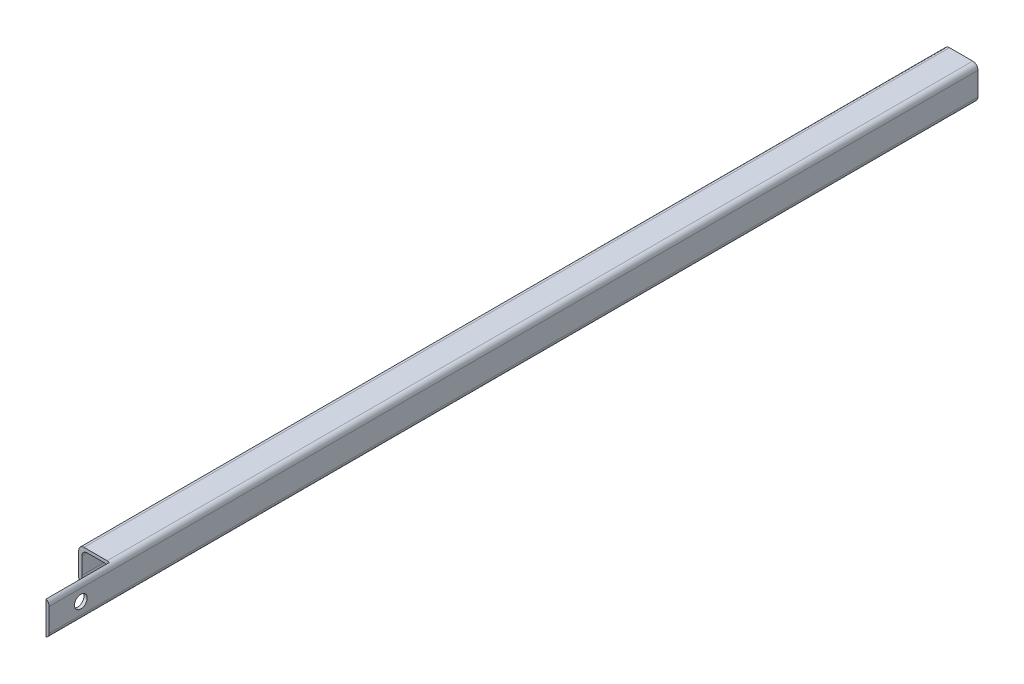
SolidWorks part; units mm, degrees
ref_plane "Plan1" through (0, 0, 0) normal (0, 0, 1) x (1, 0, 0)
ref_plane "Plan2" through (0, 0, 0) normal (0, 1, 0) x (1, 0, 0)
ref_plane "Plan3" through (0, 0, 0) normal (1, 0, 0) x (0, 0, -1)
sketch "Esquisse1" plane through (0, 0, 0) normal (0, 0, 1) x (1, 0, 0)
  line L0 (-5.5, 8) -> (5.5, 8)
  line L1 (-8, 5.5) -> (-8, -5.5)
  line L2 (5.5, -8) -> (-5.5, -8)
  line L3 (8, -5.5) -> (8, 5.5)
  line L4 (-4, 6.5) -> (4, 6.5)
  line L5 (-6.5, 4) -> (-6.5, -4)
  line L6 (4, -6.5) -> (-4, -6.5)
  line L7 (6.5, -4) -> (6.5, 4)
  line L8 (-48.7418, 0) -> (48.7418, 0) construction
  line L9 (0, 57.3432) -> (0, -57.3432) construction
  arc A0 (-4, 6.5) -> (-6.5, 4) centre (-4, 4) ccw
  arc A1 (6.5, 4) -> (4, 6.5) centre (4, 4) ccw
  arc A2 (6.5, -4) -> (4, -6.5) centre (4, -4) cw
  arc A3 (-6.5, -4) -> (-4, -6.5) centre (-4, -4) ccw
  arc A4 (-5.5, 8) -> (-8, 5.5) centre (-5.5, 5.5) ccw
  arc A5 (8, 5.5) -> (5.5, 8) centre (5.5, 5.5) ccw
  arc A6 (8, -5.5) -> (5.5, -8) centre (5.5, -5.5) cw
  arc A7 (-5.5, -8) -> (-8, -5.5) centre (-5.5, -5.5) cw
  dimension "D1" = 2.5
  dimension "D2" = 16
  dimension "D3" = 13
  dimension "D4" = 13
  dimension "D5" = 16
extrude "Base-Extrusion" add sketch "Esquisse1" along normal blind 440
sketch "Esquisse2" plane through (0, 0, 0) normal (0, 1, 0) x (1, 0, 0)
  line L0 (6.5, -440) -> (-8, -440)
  line L1 (6.5, -440) -> (6.5, -410)
  line L2 (-8, -410) -> (6.5, -410)
  line L3 (-8, -410) -> (-8, -440)
  line L4 (-5.5, -440) -> (5.5, -440) construction
  line L5 (6.5, -440) -> (6.5, 0) construction
  line L6 (-8, -440) -> (-8, 0) construction
  dimension "D1" = 410
extrude "Enlèv. mat.-Extru.1" cut sketch "Esquisse2" against normal through all and the other way through all
sketch "Esquisse3" plane through (0, 0, 0) normal (1, 0, 0) x (0, 0, -1)
  line L0 (-410, -5.5) -> (-410, 5.5) construction
  circle A0 centre (-425, 0) radius 3
  dimension "D1" = 6
  dimension "D2" = 15
extrude "Enlèv. mat.-Extru.3" cut sketch "Esquisse3" along normal through all
